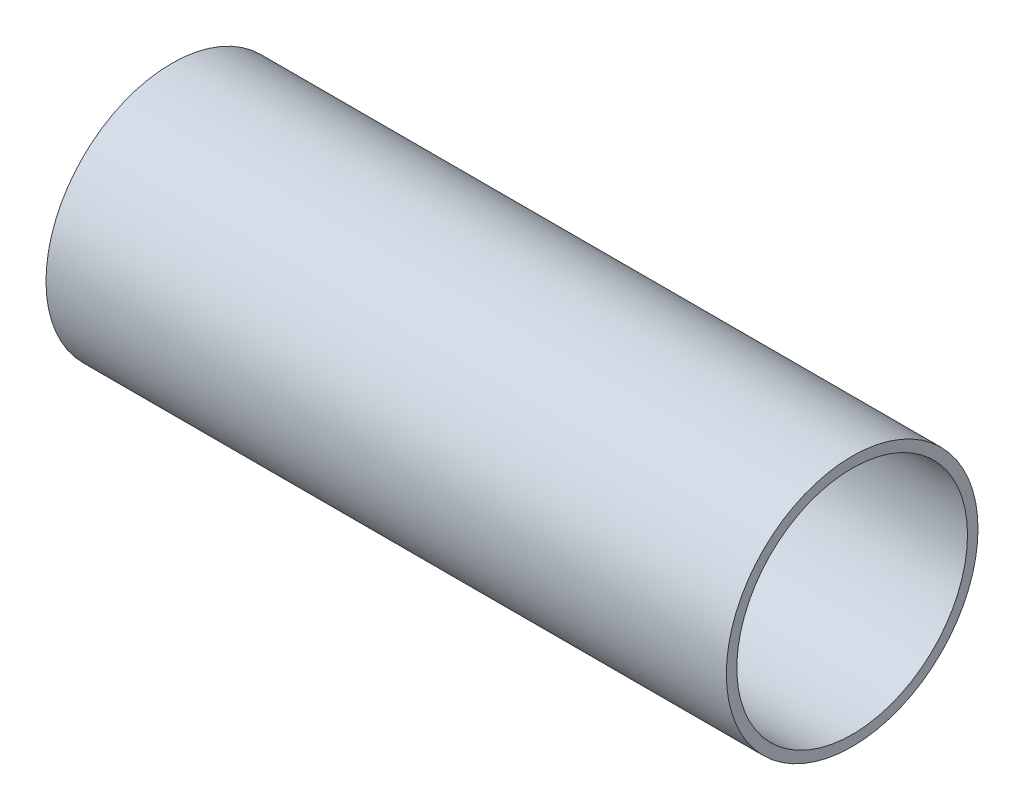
SolidWorks part; units mm, degrees
ref_plane "Front Plane" through (0, 0, 0) normal (0, 0, 1) x (1, 0, 0)
ref_plane "Top Plane" through (0, 0, 0) normal (0, 1, 0) x (1, 0, 0)
ref_plane "Right Plane" through (0, 0, 0) normal (1, 0, 0) x (0, 0, -1)
sketch "Sketch1" plane through (0, 0, 0) normal (1, 0, 0) x (0, 0, -1)
  circle A0 centre (0, 0) radius 76.2
  circle A1 centre (0, 0) radius 69.85
  dimension "D1" = 139.7
  dimension "D2" = 152.4
extrude "Boss-Extrude1" add sketch "Sketch1" along normal mid plane 412
